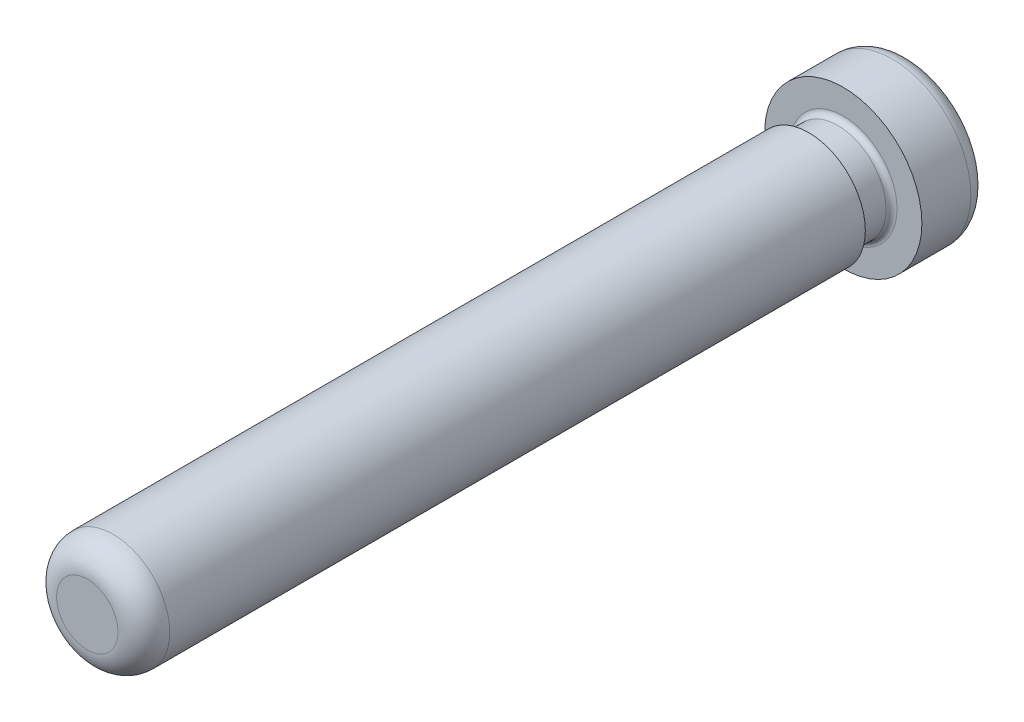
SolidWorks part; units mm, degrees
ref_plane "Спереди" through (0, 0, 0) normal (0, 0, 1) x (1, 0, 0)
ref_plane "Сверху" through (0, 0, 0) normal (0, 1, 0) x (1, 0, 0)
ref_plane "Справа" through (0, 0, 0) normal (1, 0, 0) x (0, 0, -1)
sketch "Эскиз1" plane through (0, 0, 0) normal (1, 0, 0) x (0, 0, -1)
  line L0 (0, 0) -> (41.2811, 0) construction
  line L1 (0, 0) -> (37.846, 0)
  line L2 (37.846, 0) -> (37.846, 2.8257)
  line L3 (37.0522, 3.6195) -> (34.798, 3.6195)
  line L4 (34.798, 3.6195) -> (34.798, 2.4765)
  line L5 (34.544, 2.2225) -> (33.4645, 2.2225)
  line L6 (33.2105, 2.4765) -> (33.2105, 2.6035)
  line L7 (33.2105, 2.6035) -> (1.1906, 2.6035)
  line L8 (0, 1.4129) -> (0, 0)
  arc A0 (1.1906, 2.6035) -> (0, 1.4129) centre (1.1906, 1.4129) ccw
  arc A1 (37.846, 2.8257) -> (37.0522, 3.6195) centre (37.0522, 2.8257) ccw
  arc A2 (34.798, 2.4765) -> (34.544, 2.2225) centre (34.544, 2.4765) cw
  arc A3 (33.4645, 2.2225) -> (33.2105, 2.4765) centre (33.4645, 2.4765) cw
  dimension "D7" = 1.1906
  dimension "D8" = 0.7937
  dimension "D9" = 0.254
  dimension "D1" = 37.846
  dimension "D2" = 1.5875
  dimension "D3" = 3.048
  dimension "D4" = 5.207
  dimension "D5" = 4.445
  dimension "D6" = 7.239
revolve "Повернуть1" add sketch "Эскиз1" angle 360 about L0
